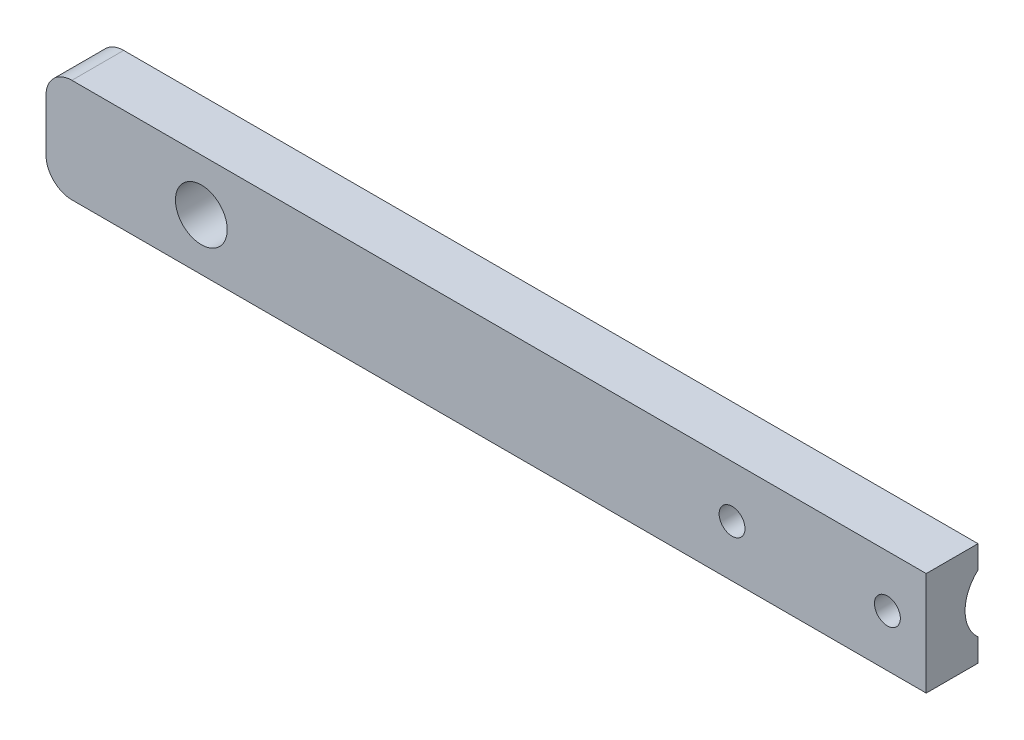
SolidWorks part; units mm, degrees
ref_plane "Front Plane" through (0, 0, 0) normal (0, 0, 1) x (1, 0, 0)
ref_plane "Top Plane" through (0, 0, 0) normal (0, 1, 0) x (1, 0, 0)
ref_plane "Right Plane" through (0, 0, 0) normal (1, 0, 0) x (0, 0, -1)
sketch "Sketch1" plane through (0, 0, 0) normal (0, 0, 1) x (1, 0, 0)
  line L0 (0, 0) -> (177.8, 0) construction
  line L1 (-38.1, -12.7) -> (177.8, -12.7)
  line L2 (177.8, -12.7) -> (177.8, 12.7)
  line L3 (177.8, 12.7) -> (-38.1, 12.7)
  line L4 (-38.1, 12.7) -> (-38.1, -12.7)
  circle A0 centre (0, 0) radius 6.35
  circle A1 centre (168.275, 0) radius 3.175
  circle A2 centre (130.175, 0) radius 3.175
  dimension "D4" = 12.7
  dimension "D5" = 6.35
  dimension "D1" = 38.1
  dimension "D2" = 25.4
  dimension "D3" = 177.8
  dimension "D6" = 38.1
  dimension "D7" = 9.525
  dimension "D8" = 130.175
extrude "Boss-Extrude1" add sketch "Sketch1" along normal mid plane 12.7
fillet "Fillet1" radius 6.35 2 edges at (-38.1, -12.7, 0) (-38.1, 12.7, 0)
sketch "Sketch2" plane through (177.8, 0, 0) normal (1, 0, 0) x (0, 0, -1)
  circle A0 centre (12.7, 0) radius 9.525
  dimension "D1" = 19.05
  dimension "D2" = 12.7
extrude "Cut-Extrude1" cut sketch "Sketch2" against normal blind 57.15
